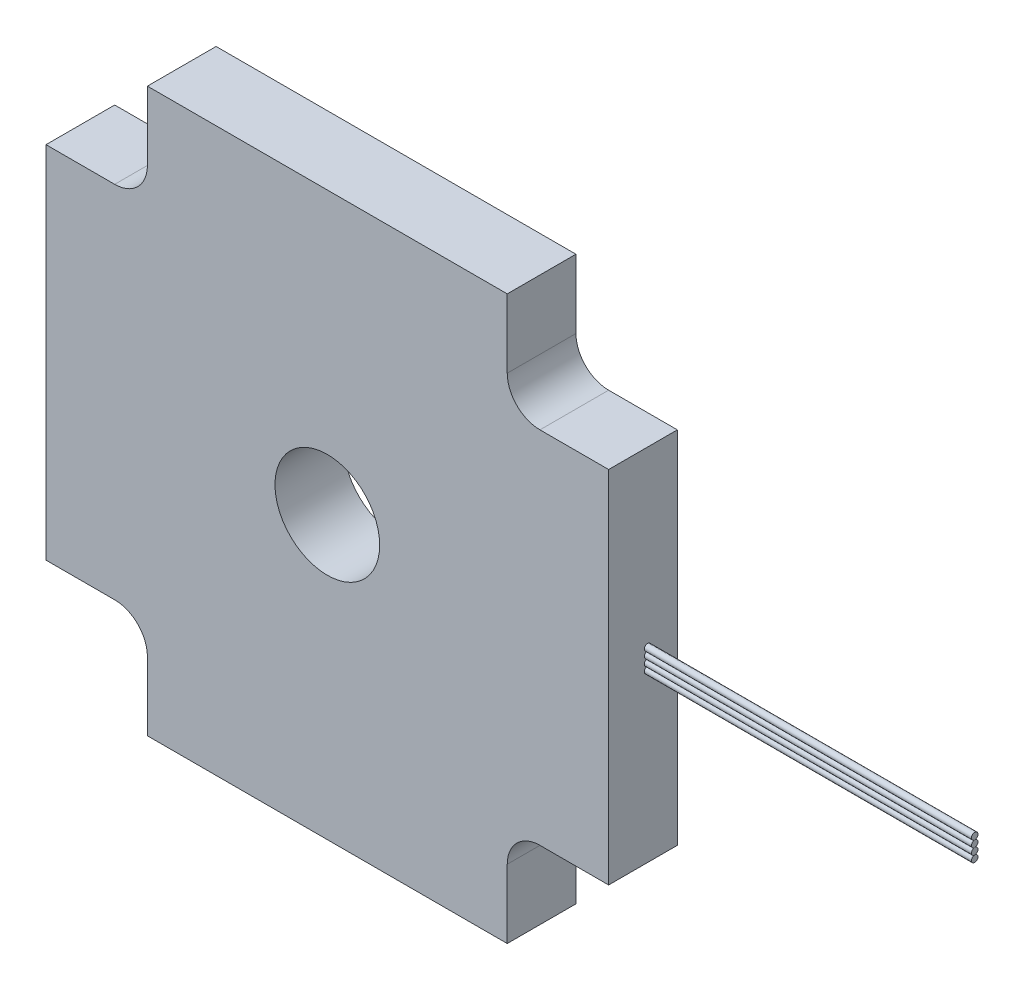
SolidWorks part; units mm, degrees
ref_plane "前视" through (0, 0, 0) normal (0, 0, 1) x (1, 0, 0)
ref_plane "上视" through (0, 0, 0) normal (0, 1, 0) x (1, 0, 0)
ref_plane "右视" through (0, 0, 0) normal (1, 0, 0) x (0, 0, -1)
sketch "草图1" plane through (0, 0, 0) normal (0, 0, 1) x (1, 0, 0)
  line L0 (-27.5, 27.5) -> (-27.5, 43)
  line L1 (27.5, -43) -> (-27.5, -43)
  line L2 (43, -27.5) -> (43, 27.5)
  line L3 (27.5, 43) -> (-27.5, 43)
  line L4 (-43, -27.5) -> (-43, 27.5)
  line L5 (-27.5, -27.5) -> (-43, -27.5)
  line L6 (-27.5, 27.5) -> (-43, 27.5)
  line L7 (43, -27.5) -> (27.5, -27.5)
  line L9 (43, 27.5) -> (27.5, 27.5)
  line L11 (27.5, 27.5) -> (27.5, 43)
  line L14 (27.5, -43) -> (27.5, -27.5)
  line L16 (-27.5, -43) -> (-27.5, -27.5)
  point P6 (0, 0)
  point P11 (0, 0)
  dimension "D3" = 55
  dimension "D4" = 55
extrude "凸台-拉伸1" add sketch "草图1" along normal blind 10.5
sketch "草图2" plane through (0, 0, 10.5) normal (0, 0, 1) x (1, 0, 0)
  circle A0 centre (0, 0) radius 8
extrude "切除-拉伸1" cut sketch "草图2" against normal blind 10.5
fillet "圆角1" radius 5 1 edges at (-27.5, 27.5, 5.25)
fillet "圆角2" radius 5 1 edges at (27.5, 27.5, 5.25)
fillet "圆角3" radius 5 1 edges at (27.5, -27.5, 5.25)
fillet "圆角4" radius 5 1 edges at (-27.5, -27.5, 5.25)
sketch "草图3" plane through (43, 0, 0) normal (1, 0, 0) x (0, 0, -1)
  circle A0 centre (-4.5448, 0) radius 0.5
  circle A1 centre (-4.5448, 1) radius 0.5
  circle A2 centre (-4.5448, -1) radius 0.5
  circle A3 centre (-4.5448, -2) radius 0.5
extrude "凸台-拉伸2" add sketch "草图3" along normal blind 50 separate body contours A2 | A3 | A0 | A1
